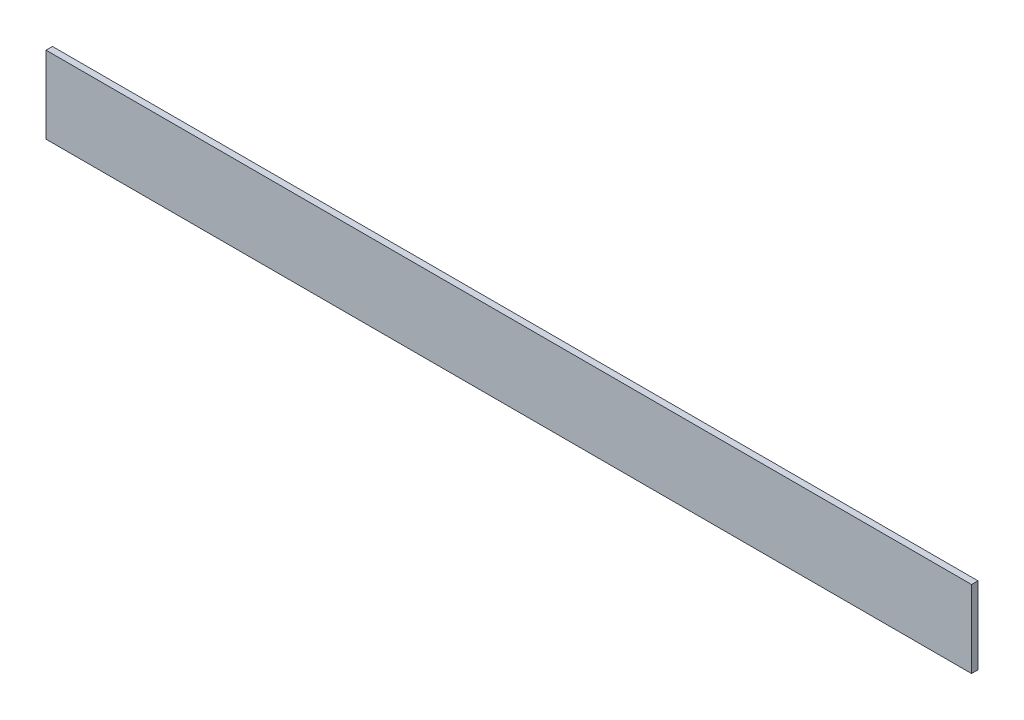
SolidWorks part; units mm, degrees
ref_plane "Front Plane" through (0, 0, 0) normal (0, 0, 1) x (1, 0, 0)
ref_plane "Top Plane" through (0, 0, 0) normal (0, 1, 0) x (1, 0, 0)
ref_plane "Right Plane" through (0, 0, 0) normal (1, 0, 0) x (0, 0, -1)
sketch "Sketch1" plane through (0, 0, 0) normal (0, 0, 1) x (1, 0, 0)
  line L1 (-457.2, -38.1) -> (457.2, -38.1)
  line L2 (-457.2, -38.1) -> (-457.2, 38.1)
  line L3 (-457.2, 38.1) -> (457.2, 38.1)
  line L4 (457.2, -38.1) -> (457.2, 38.1)
  line L5 (-457.2, -38.1) -> (457.2, 38.1) construction
  line L6 (-457.2, 38.1) -> (457.2, -38.1) construction
  point P0 (0, 0)
  dimension "D1" = 76.2
  dimension "D2" = 914.4
extrude "Boss-Extrude1" add sketch "Sketch1" along normal blind 6.35
